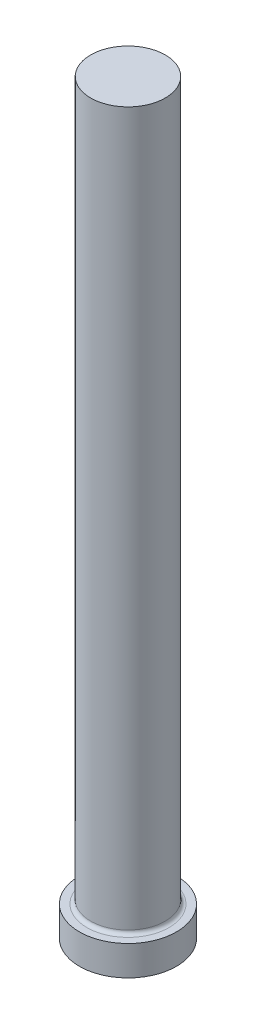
SolidWorks part; units mm, degrees
ref_plane "Plano frontal" through (0, 0, 0) normal (0, 0, 1) x (1, 0, 0)
ref_plane "Plano superior" through (0, 0, 0) normal (0, 1, 0) x (1, 0, 0)
ref_plane "Plano direito" through (0, 0, 0) normal (1, 0, 0) x (0, 0, -1)
sketch "Esboço1" plane through (0, 0, 0) normal (0, 0, 1) x (1, 0, 0)
  line L0 (0, 0) -> (13, 0)
  line L1 (13, 0) -> (13, 8)
  line L2 (13, 8) -> (11, 8)
  line L3 (10, 9) -> (10, 200)
  line L4 (10, 200) -> (0, 200)
  line L5 (0, 200) -> (0, 0) construction
  line L6 (0, 0) -> (0, 200)
  arc A0 (11, 8) -> (10, 9) centre (11, 9) cw
  dimension "D3" = 1
  dimension "D1" = 26
  dimension "D2" = 20
  dimension "D4" = 8
  dimension "D5" = 200
revolve "Revolução1" add sketch "Esboço1" angle 360 about L5
sketch "Esboço2"
  dimension "D1" = 0.975
  dimension "D2" = 2.275
  dimension "D3" = 1.4625
  dimension "D4" = 6.9875
wrap "Envolver1" sketch "Esboço2" source sketch "Esboço2" thickness 0.1 parameters "D1"=0.1
